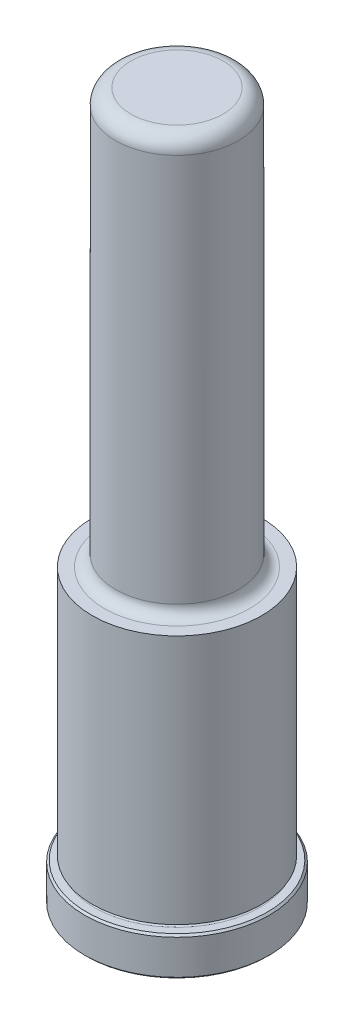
SolidWorks part; units mm, degrees
ref_plane "Front Plane" through (0, 0, 0) normal (0, 0, 1) x (1, 0, 0)
ref_plane "Top Plane" through (0, 0, 0) normal (0, 1, 0) x (1, 0, 0)
ref_plane "Right Plane" through (0, 0, 0) normal (1, 0, 0) x (0, 0, -1)
sketch "Sketch1" plane through (0, 0, 0) normal (1, 0, 0) x (0, 0, -1)
  line L0 (0, 0) -> (19.05, 0)
  line L1 (19.05, 0) -> (19.05, 7.9248)
  line L2 (19.05, 7.9248) -> (17.0688, 7.9248)
  line L3 (16.6878, 2.6782) -> (16.6878, 5.9795) construction
  line L4 (17.0688, 8.6868) -> (17.4752, 8.6868)
  line L5 (17.4752, 8.6868) -> (17.4752, 60.325)
  line L6 (17.4752, 60.325) -> (14.9733, 60.325)
  line L7 (12.6873, 62.611) -> (12.6873, 146.05)
  line L9 (12.6873, 146.05) -> (0, 146.05)
  line L10 (0, 146.05) -> (0, 0)
  line L11 (0, 0) -> (0, -7.2694) construction
  arc A0 (17.0688, 8.6868) -> (17.0688, 7.9248) centre (17.0688, 8.3058) ccw
  arc A1 (14.9733, 60.325) -> (12.6873, 62.611) centre (14.9733, 62.611) cw
  point P2 (12.6873, 146.05)
  point P14 (12.6873, 145.714)
  point P19 (12.6873, 60.325)
  dimension "D14" = 0.762
  dimension "D8" = 2.286
  dimension "T" = 7.9248
  dimension "D2" = 0.762
  dimension "M" = 38.1
  dimension "B" = 34.9504
  dimension "L" = 146.05
  dimension "D7" = 0.7874
  dimension "A" = 60.325
  dimension "D" = 25.3746
  dimension "D15" = 85.725
revolve "Revolve1" add sketch "Sketch1" angle 360 about L11
chamfer "Chamfer1" distance 0.381 angle 45 2 edges at (0, 0, 19.05) (0, 7.9248, 19.05)
fillet "Fillet7" radius 3.175 1 edges at (0, 146.05, 12.6873)
